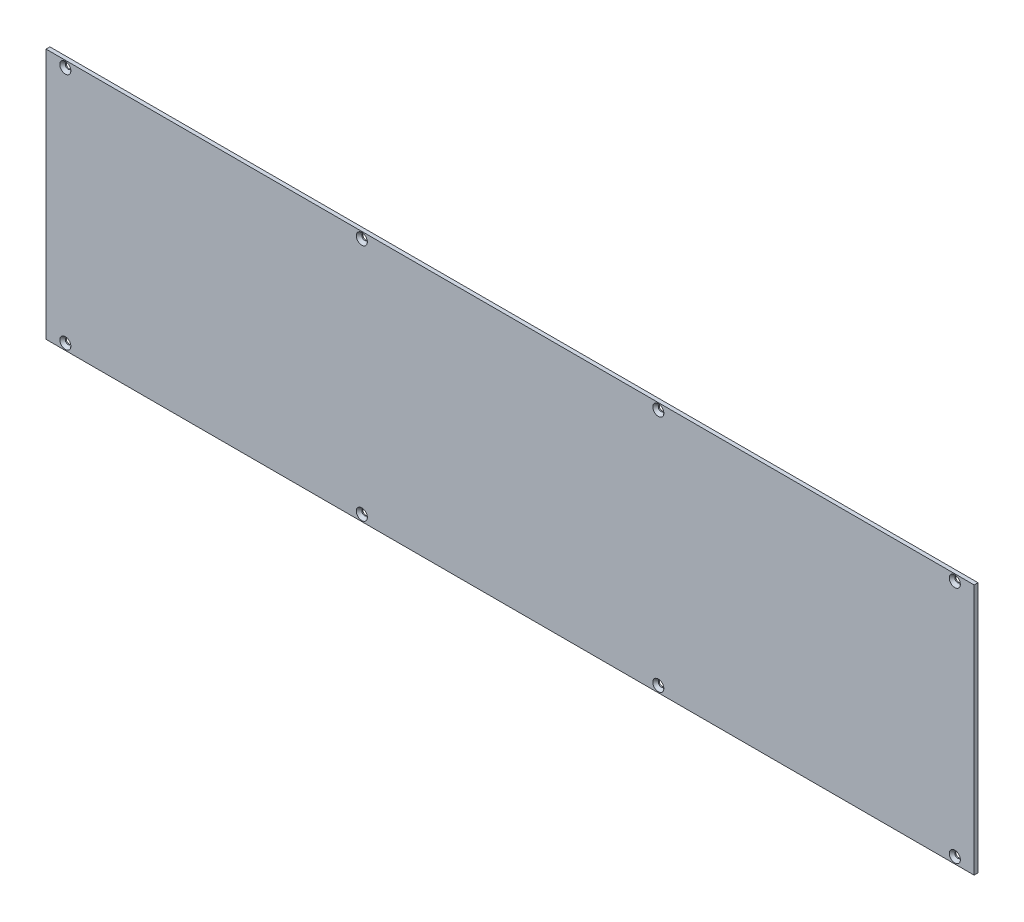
SolidWorks part; units mm, degrees
ref_plane "Спереди" through (0, 0, 0) normal (0, 0, 1) x (1, 0, 0)
ref_plane "Сверху" through (0, 0, 0) normal (0, 1, 0) x (1, 0, 0)
ref_plane "Справа" through (0, 0, 0) normal (1, 0, 0) x (0, 0, -1)
sketch "Эскиз1" plane through (0, 0, 0) normal (0, 0, 1) x (1, 0, 0)
  line L1 (0, 0) -> (720, 0)
  line L2 (0, 0) -> (0, 195)
  line L3 (0, 195) -> (720, 195)
  line L4 (720, 0) -> (720, 195)
  dimension "D1" = 195
  dimension "D2" = 720
extrude "Бобышка-Вытянуть1" add sketch "Эскиз1" along normal blind 3
sketch "Эскиз2" plane through (0, 0, 3) normal (0, 0, 1) x (1, 0, 0)
  line L0 (360, 240.441) -> (360, -97.4195) construction
  line L1 (-67.7091, 97.5) -> (834.4898, 97.5) construction
  line L2 (720, 195) -> (0, 195) construction
  line L3 (0, 195) -> (0, 0) construction
  circle A0 centre (15, 190) radius 4.3
  circle A1 centre (245, 190) radius 4.3
  circle A2 centre (475, 190) radius 4.3
  circle A3 centre (705, 190) radius 4.3
  circle A4 centre (15, 5) radius 4.3
  circle A5 centre (245, 5) radius 4.3
  circle A6 centre (475, 5) radius 4.3
  circle A7 centre (705, 5) radius 4.3
  point P6 (360, 195)
  point P9 (0, 97.5)
  dimension "D1" = 8.6
  dimension "D2" = 8.6
  dimension "D3" = 8.6
  dimension "D4" = 8.6
  dimension "D5" = 8.6
  dimension "D6" = 8.6
  dimension "D7" = 8.6
  dimension "D8" = 8.6
  dimension "D9" = 185
  dimension "D10" = 185
  dimension "D11" = 15
  dimension "D12" = 230
extrude "Вырез-Вытянуть1" cut sketch "Эскиз2" against normal blind 2.15
draft "Уклон1" type of draft neutral plane draft angle 45 faces to draft 8 parameters "D1"=45
sketch "Эскиз3" plane through (0, 0, 0.85) normal (0, 0, 1) x (1, 0, 0)
  circle A0 centre (15, 5) radius 2.15
  circle A1 centre (15, 5) radius 2.15 construction
  dimension "D1" = 4.3
extrude "Вырез-Вытянуть2" cut sketch "Эскиз3" against normal through all
sketch "Эскиз4" plane through (0, 0, 0.85) normal (0, 0, 1) x (1, 0, 0)
  circle A0 centre (245, 5) radius 2.15
  circle A1 centre (245, 5) radius 2.15 construction
  dimension "D1" = 4.3
extrude "Вырез-Вытянуть3" cut sketch "Эскиз4" against normal through all
sketch "Эскиз5" plane through (0, 0, 0.85) normal (0, 0, 1) x (1, 0, 0)
  circle A0 centre (475, 5) radius 2.15
  circle A1 centre (475, 5) radius 2.15 construction
  dimension "D1" = 4.3
extrude "Вырез-Вытянуть4" cut sketch "Эскиз5" against normal through all
sketch "Эскиз6" plane through (0, 0, 0.85) normal (0, 0, 1) x (1, 0, 0)
  circle A0 centre (705, 5) radius 2.15
  circle A1 centre (705, 5) radius 2.15 construction
  dimension "D1" = 4.3
extrude "Вырез-Вытянуть5" cut sketch "Эскиз6" against normal through all
sketch "Эскиз7" plane through (0, 0, 0.85) normal (0, 0, 1) x (1, 0, 0)
  circle A0 centre (705, 190) radius 2.15
  circle A1 centre (705, 190) radius 2.15 construction
  dimension "D1" = 4.3
extrude "Вырез-Вытянуть6" cut sketch "Эскиз7" against normal through all
sketch "Эскиз8" plane through (0, 0, 0.85) normal (0, 0, 1) x (1, 0, 0)
  circle A0 centre (475, 190) radius 2.15
  circle A1 centre (475, 190) radius 2.15 construction
  dimension "D1" = 4.3
extrude "Вырез-Вытянуть7" cut sketch "Эскиз8" against normal through all
sketch "Эскиз9" plane through (0, 0, 0.85) normal (0, 0, 1) x (1, 0, 0)
  circle A0 centre (245, 190) radius 2.15
  circle A1 centre (245, 190) radius 2.15 construction
  dimension "D1" = 4.3
extrude "Вырез-Вытянуть8" cut sketch "Эскиз9" against normal through all
sketch "Эскиз10" plane through (0, 0, 0.85) normal (0, 0, 1) x (1, 0, 0)
  circle A0 centre (15, 190) radius 2.15
  circle A1 centre (15, 190) radius 2.15 construction
  dimension "D1" = 4.3
extrude "Вырез-Вытянуть9" cut sketch "Эскиз10" against normal through all
